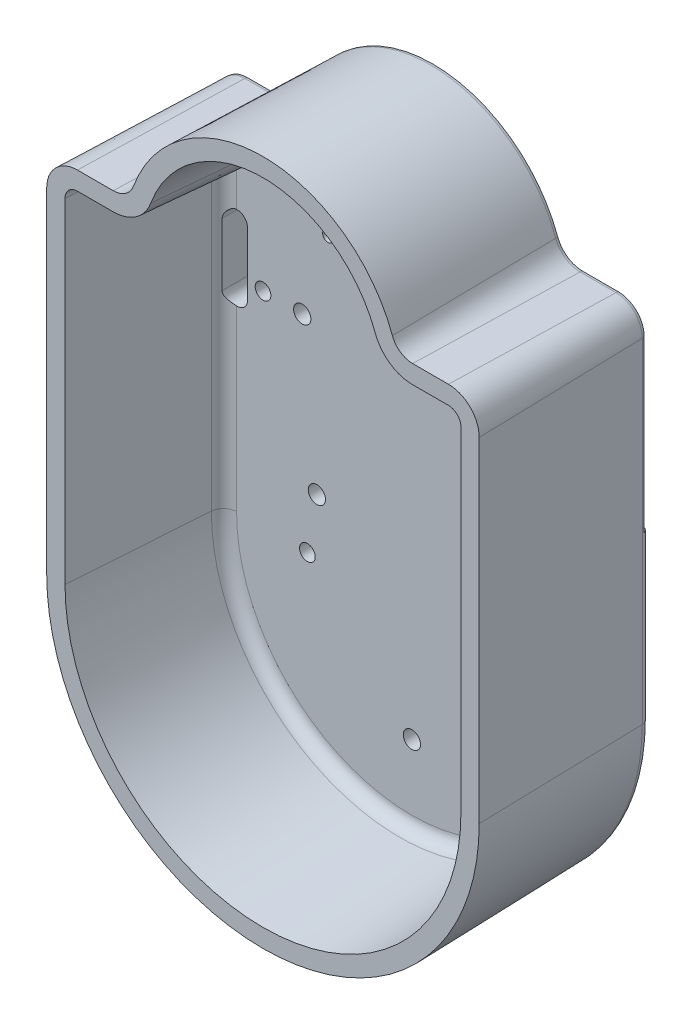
SolidWorks part; units mm, degrees
ref_plane "Face" through (0, 0, 0) normal (0, 0, 1) x (1, 0, 0)
ref_plane "Dessus" through (0, 0, 0) normal (0, 1, 0) x (1, 0, 0)
ref_plane "Droite" through (0, 0, 0) normal (1, 0, 0) x (0, 0, -1)
sketch "Esquisse1" plane through (0, 0, 0) normal (0, 0, 1) x (1, 0, 0)
  line L0 (-81, 128) -> (-81, 0)
  line L1 (81, 128) -> (81, 0)
  line L2 (-71, 138) -> (-57.2713, 138)
  line L3 (71, 138) -> (57.2713, 138)
  line L4 (-106.5141, 127) -> (138.6871, 127) construction
  line L5 (0, 0) -> (0, 197.6296) construction
  line L6 (0, 197.6296) -> (0, -118.1507) construction
  arc A0 (-81, 0) -> (81, 0) centre (0, 0) ccw
  arc A1 (47.8825, 144.5574) -> (-47.8825, 144.5574) centre (0, 127) ccw
  arc A2 (57.2713, 138) -> (47.8825, 144.5574) centre (57.2713, 148) cw
  arc A3 (81, 128) -> (71, 138) centre (71, 128) ccw
  arc A4 (-57.2713, 138) -> (-47.8825, 144.5574) centre (-57.2713, 148) ccw
  arc A5 (-81, 128) -> (-71, 138) centre (-71, 128) cw
  point P17 (81, 138)
  point P22 (159.2198, 138)
  dimension "D1" = 81
  dimension "D4" = 11
  dimension "D5" = 51
  dimension "D2" = 10
  dimension "D6" = 10
  dimension "D7" = 10
  dimension "D8" = 10
  dimension "D3" = 138
extrude "Extrusion1" add sketch "Esquisse1" along normal blind 67 draft 1.5
fillet "Congé1" radius 3 10 edges at (-81, 64, 0) (-78.0711, 135.0711, 0) (-64.1356, 138, 0) (-51.5453, 139.8016, 0) (0, 178, 0) (51.5453, 139.8016, 0) (64.1356, 138, 0) (78.0711, 135.0711, 0) (81, 64, 0) (0, -81, 0)
sketch "Esquisse2" plane through (0, 0, 67) normal (0, 0, 1) x (1, 0, 0)
  line L12 (71, 132.7545) -> (57.2713, 132.7545)
  line L13 (75.7545, 0) -> (75.7545, 128)
  line L14 (-75.7545, 128) -> (-75.7545, 0)
  line L15 (-57.2713, 132.7545) -> (-71, 132.7545)
  line L16 (71, 132.7545) -> (57.2713, 132.7545)
  line L17 (75.7545, 0) -> (75.7545, 128)
  line L18 (-75.7545, 128) -> (-75.7545, 0)
  line L19 (-57.2713, 132.7545) -> (-71, 132.7545)
  arc A18 (42.9576, 142.7515) -> (57.2713, 132.7545) centre (57.2713, 148) ccw
  arc A19 (-75.7545, 0) -> (75.7545, 0) centre (0, 0) ccw
  arc A20 (-57.2713, 132.7545) -> (-42.9576, 142.7515) centre (-57.2713, 148) ccw
  arc A21 (42.9576, 142.7515) -> (-42.9576, 142.7515) centre (0, 127) ccw
  arc A22 (42.9576, 142.7515) -> (57.2713, 132.7545) centre (57.2713, 148) ccw
  arc A23 (-75.7545, 0) -> (75.7545, 0) centre (0, 0) ccw
  arc A24 (-57.2713, 132.7545) -> (-42.9576, 142.7515) centre (-57.2713, 148) ccw
  arc A25 (42.9576, 142.7515) -> (-42.9576, 142.7515) centre (0, 127) ccw
  arc A26 (75.7545, 128) -> (71, 132.7545) centre (71, 128) ccw
  arc A27 (75.7545, 128) -> (71, 132.7545) centre (71, 128) ccw
  arc A28 (-71, 132.7545) -> (-75.7545, 128) centre (-71, 128) ccw
  arc A29 (-71, 132.7545) -> (-75.7545, 128) centre (-71, 128) ccw
  dimension "D1" = 7
extrude "Enlèv. mat.-Extru.2" cut sketch "Esquisse2" against normal blind 57 draft 4
fillet "Congé2" radius 5 10 edges at (46.2594, 132.2334, 10) (64.1356, 128.7686, 10) (71.5435, 128.5435, 10) (71.7686, 64, 10) (0, -71.7686, 10) (-71.7686, 64, 10) (-71.5435, 128.5435, 10) (-64.1356, 128.7686, 10) (-46.2594, 132.2334, 10) (0, 168.7686, 10)
hole_wizard "Fraisage pour vis à tête fraisée M61" positions "Esquisse3D4" profile "Esquisse8" countersink size "M6" standard "ISO"
sketch3d "Esquisse3D4"
  point P0 (-36.3731, 21, 0)
  point P2 (36.3731, 21, 0)
  point P4 (0, -42, 0)
  dimension "D1" = 42
  dimension "D2" = 42
  dimension "D3" = 120
  dimension "D4" = 42
  dimension "D5" = 120
sketch "Esquisse8" plane through (-36.3731, 21, 0) normal (1, 0, 0) x (0, 1, 0)
  line L0 (0, 0) -> (0, 67)
  line L1 (0, 67) -> (3.3, 67)
  line L2 (3.3, 67) -> (3.3, 3)
  line L3 (3.3, 3) -> (6.3, 0)
  line L5 (6.3, 0) -> (0, 0)
  line L6 (-3.3, 3) -> (-6.3, 0) construction
  line L11 (0, -6.35) -> (0, 107.95) construction
  dimension "Diamètre du perçage jusqu'au prochain" = 6.6
  dimension "Profondeur du perçage jusqu'au prochain" = 67
  dimension "Diamètre du fraisage entrant" = 12.6
  dimension "Angle du fraisage entrant" = 90
other "Perçage1"
sketch "Esquisse9" plane through (0, 0, 0) normal (0, 0, -1) x (-1, 0, 0)
  circle A0 centre (40, 0) radius 3
  dimension "D1" = 6
  dimension "D2" = 40
other "Perçage2"
sketch "Esquisse10" plane through (0, 0, 0) normal (0, 0, -1) x (-1, 0, 0)
  circle A0 centre (-40, 0) radius 3
  dimension "D1" = 6
  dimension "D2" = 40
sketch "Esquisse11" plane through (0, 0, 0) normal (1, 0, 0) x (0, 0, -1)
  line L1 (0.0018, 63) -> (-1.9982, 63)
  line L2 (0.0018, 63) -> (0.0018, 178.0783)
  line L3 (0.0018, 178.0783) -> (-1.9982, 178.0783)
  line L4 (-1.9982, 63) -> (-1.9982, 178.0783)
  dimension "D1" = 2
  dimension "D2" = 63
extrude "Enlèv. mat.-Extru.3" cut sketch "Esquisse11" against normal through all and the other way through all
hole_wizard "Trou taraudé M61" positions "Esquisse3D5" profile "Esquisse14" tap size "M6" standard "ISO"
sketch3d "Esquisse3D5"
  line L3 (59.5012, 138, 0) -> (42.0034, 138, 0) construction
  line L4 (71, 138, 0) -> (57.2713, 138, 0) construction
  line L6 (-106.5141, 127, 0) -> (138.6871, 127, 0) construction
  line L7 (-63.6326, 138, 0) -> (-42.7296, 138, 0) construction
  line L8 (-71, 138, 0) -> (-57.2713, 138, 0) construction
  line L16 (0, 0, 0) -> (0, 184.1112, 0) construction
  point P0 (57.035, 123.1337, 1.9982)
  point P2 (57.035, 78.1337, 1.9982)
  point P25 (-56.6229, 127, 0)
  point P29 (-56.965, 78.1337, 1.9982)
  point P31 (-56.965, 123.1337, 1.9982)
  point P33 (-114.1553, 95.3826, 0)
  point P43 (-90.0355, 129.2575, 0)
  point P60 (-102.5601, 85.316, 0)
  dimension "D1" = 114
  dimension "D3" = 15
  dimension "D2" = 114
  dimension "D4" = 45
  dimension "D5" = 15
  dimension "D6" = 57
  dimension "D7" = 57
  dimension "D8" = 45
sketch "Esquisse14" plane through (57.035, 123.1337, 1.9982) normal (1, 0, 0) x (0, 1, 0)
  line L0 (0, 0) -> (0, 26.5022)
  line L1 (0, 26.5022) -> (2.5, 25)
  line L2 (2.5, 25) -> (2.5, 16)
  line L3 (2.5, 16) -> (3, 16)
  line L4 (3, 16) -> (3, 0)
  line L5 (3, 0) -> (0, 0)
  line L10 (0, 26.5022) -> (-2.5, 25) construction
  line L11 (0, -6.35) -> (0, 107.95) construction
  dimension "Diamètre du trou pour taraudage" = 5
  dimension "Profondeur du trou pour taraudage" = 25
  dimension "Diamètre principal du filetage" = 6
  dimension "Profondeur du filetage" = 16
  dimension "Angle de pointe" = 118
hole_wizard "Dégagement M61" positions "Esquisse3D6" profile "Esquisse16" hole size "M6" standard "ISO"
sketch3d "Esquisse3D6"
  line L3 (-61.2378, 138, 0) -> (-48.8714, 138, 0) construction
  line L4 (-71, 138, 0) -> (-57.2713, 138, 0) construction
  line L5 (57.035, 123.1337, 1.9982) -> (70.0639, 123.1337, 1.9982) construction
  line L6 (57.035, 123.1337, 10) -> (57.035, 123.1337, 1.9982) construction
  circle A1 centre (57.035, 123.1337, 1.9982) radius 3 construction
  circle A2 centre (-56.965, 78.1337, 1.9982) radius 3 construction
  point P0 (-41.9653, 78.0333, 1.9982)
  point P2 (67.535, 123.1337, 1.9982)
  point P23 (57.035, 123.1337, -1.0018)
  point P26 (-56.965, 78.1337, -1.0018)
  dimension "D2" = 10.5
  dimension "D3" = 15
  dimension "D4" = 60
sketch "Esquisse16" plane through (-41.9653, 78.0333, 1.9982) normal (1, 0, 0) x (0, 1, 0)
  line L0 (0, 0) -> (0, 65.0018)
  line L1 (0, 65.0018) -> (3.3, 65.0018)
  line L2 (3.3, 65.0018) -> (3.3, 0)
  line L5 (3.3, 0) -> (0, 0)
  line L11 (0, -6.35) -> (0, 107.95) construction
  dimension "Diamètre du perçage jusqu'au prochain" = 6.6
  dimension "Profondeur du perçage jusqu'au prochain" = 65.0018
other "Perçage4"
sketch "Esquisse20" plane through (0, 0, 1.9982) normal (0, 0, -1) x (-1, 0, 0)
  circle A0 centre (0.0064, 126.9972) radius 32
  dimension "D1" = 64
sketch "Esquisse22" plane through (0, 0, 1.9982) normal (0, 0, -1) x (-1, 0, 0)
  circle A0 centre (0, 127) radius 37
  dimension "D1" = 74
hole_wizard "Trou taraudé M42" positions "Esquisse3D9" profile "Esquisse25" tap size "M4" standard "ISO"
sketch3d "Esquisse3D9"
  line L1 (0, 127, 1.9982) -> (0.2291, 163.9993, 1.9982) construction
  line L3 (0, 127, 1.9982) -> (-32.1569, 108.6988, 1.9982) construction
  line L5 (0, 127, 1.9982) -> (31.9278, 108.3019, 1.9982) construction
  line L7 (0, 0, 0) -> (0.1395, 149.5276, 1.9982) construction
  circle A0 centre (0, 127, 1.9982) radius 37 construction
  point P0 (31.9278, 108.3019, 1.9982)
  point P4 (0, 127, -35.0018)
  point P5 (-32.1569, 108.6988, 1.9982)
  point P7 (0.2291, 163.9993, 1.9982)
  dimension "D1" = 120
  dimension "D2" = 120
sketch "Esquisse25" plane through (31.9278, 108.3019, 1.9982) normal (1, 0, 0) x (0, 1, 0)
  line L0 (0, 0) -> (0, 65.0018)
  line L1 (0, 65.0018) -> (2, 65.0018)
  line L2 (2, 65.0018) -> (2, 0)
  line L5 (2, 0) -> (0, 0)
  line L11 (0, -6.35) -> (0, 107.95) construction
  dimension "Diamètre principal du filetage" = 4
  dimension "Profondeur du trou pour taraudage jusqu'au prochain" = 65.0018
sketch "Esquisse26" plane through (0, 0, 1.9982) normal (0, 0, -1) x (-1, 0, 0)
  line L0 (78.0775, 63) -> (-78.0775, 63) construction
  line L2 (62.895, 96.17) -> (62.895, 72.17)
  line L4 (70.895, 96.17) -> (70.895, 72.17)
  arc A0 (70.895, 96.17) -> (62.895, 96.17) centre (66.895, 96.17) ccw
  arc A1 (70.895, 72.17) -> (62.895, 72.17) centre (66.895, 72.17) cw
  circle A2 centre (56.965, 78.1337) radius 3 construction
  dimension "D3" = 5.93
  dimension "D1" = 8
  dimension "D2" = 24
  dimension "D4" = 9.17
extrude "Enlèv. mat.-Extru.4" cut sketch "Esquisse26" against normal through all
sketch "Esquisse28" plane through (0, 0, 67) normal (0, 0, 1) x (1, 0, 0)
  circle A0 centre (-56.965, 123.1337) radius 6
  circle A1 centre (57.035, 123.1337) radius 6
  dimension "D1" = 12
  dimension "D2" = 12
extrude "Enlèv. mat.-Extru.6" cut sketch "Esquisse28" against normal blind 58
